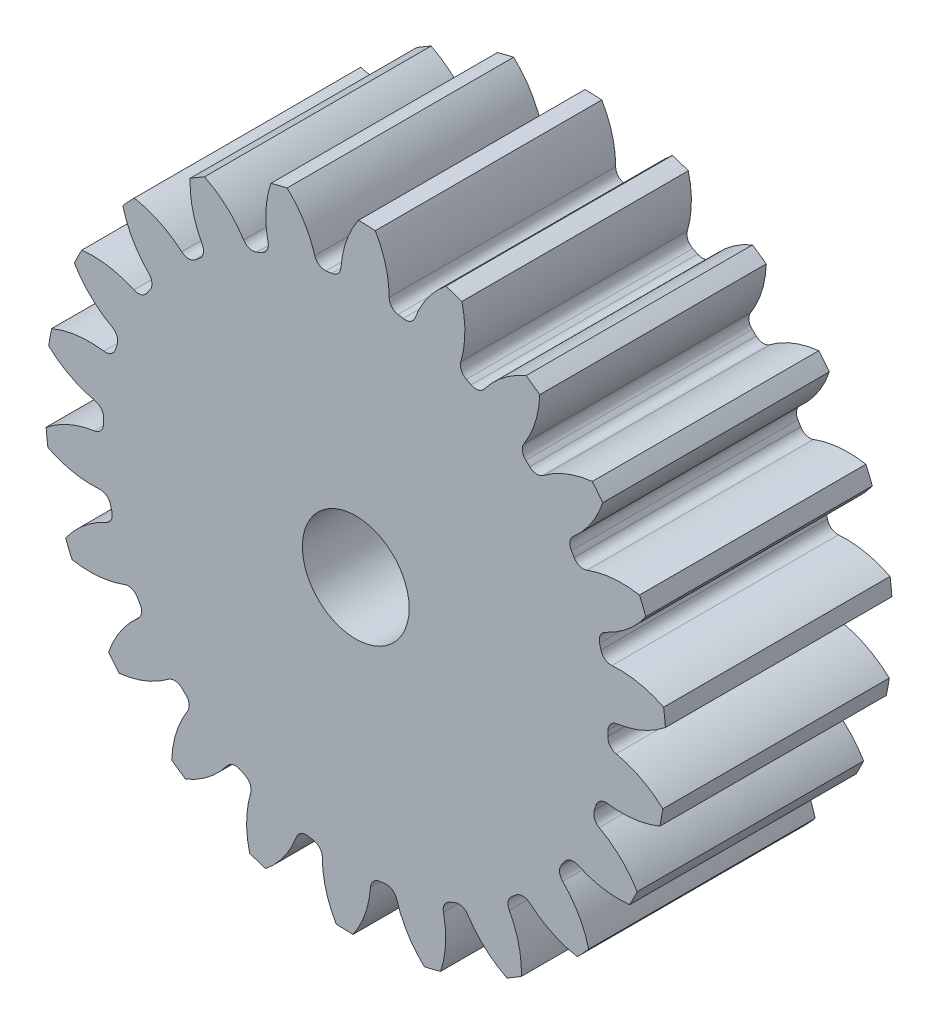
SolidWorks part; units mm, degrees
ref_plane "Front" through (0, 0, 0) normal (0, 0, 1) x (1, 0, 0)
ref_plane "Top" through (0, 0, 0) normal (0, 1, 0) x (1, 0, 0)
ref_plane "Right" through (0, 0, 0) normal (1, 0, 0) x (0, 0, -1)
sketch "Sketch3" plane through (0, 0, 0) normal (0, 0, 1) x (1, 0, 0)
  circle A0 centre (0, 0) radius 121.92
  dimension "od" = 243.84
extrude "gearBody" add sketch "Sketch3" along normal blind 88.9
sketch "Sketch2" plane through (0, 0, 0) normal (0, 0, 1) x (1, 0, 0)
  line L0 (0, 0) -> (97.0259, 40.1894) construction
  line L1 (120.8868, -18.7566) -> (0, 0) construction
  line L2 (0, 0) -> (36.3143, 0) construction
  line L3 (111.6901, 3.9507) -> (111.12, -11.943) construction
  line L5 (111.4051, -3.9962) -> (0, 0) construction
  line L7 (0, 0) -> (105.02, 0) construction
  arc A0 (105.0025, 1.9186) -> (104.5952, -9.437) centre (0, 0) ccw construction
  arc A1 (121.5311, 9.73) -> (120.5216, -18.4126) centre (0, 0) ccw construction
  arc A2 (111.6901, 3.9507) -> (111.12, -11.943) centre (0, 0) ccw construction
  arc A3 (98.9529, -4.6047) -> (99.0285, -2.497) centre (0, 0) ccw
  arc A4 (120.8868, -18.7566) -> (102.2048, -8.8376) centre (93.897, -47.038) ccw
  arc A5 (120.8868, -18.7566) -> (121.92, 10.0469) centre (0, 0) ccw
  arc A6 (121.92, 10.0469) -> (102.5753, 1.492) centre (97.0259, 40.1894) cw
  arc A7 (99.0285, -2.497) -> (102.5753, 1.492) centre (103.1623, -2.6012) cw
  arc A8 (102.2048, -8.8376) -> (98.9529, -4.6047) centre (103.0836, -4.7969) cw
  point P6 (121.92, 10.0469)
  point P22 (120.8868, -18.7566)
  dimension "baseDia" = 210.0401
  dimension "od" = 243.84
  dimension "pd" = 223.52
  dimension "rd" = 198.12
  dimension "rFillet" = 4.1351
  dimension "pointX" = 121.92
  dimension "pointY" = 10.0469
  dimension "CTT" = 15.8937
  dimension "flankCenterAngle" = 22.5
extrude "toothCut" cut sketch "Sketch2" along normal through all
pattern_circular "CirPattern1" count 22 over 360 about axis through (0, 0, 0) along (0, 0, 1) of "toothCut"
sketch "hub1Dia" plane through (0, 0, 0) normal (0, 0, -1) x (-1, 0, 0)
  circle A0 centre (0, 0) radius 12.7
  dimension "hub1Dia" = 25.4
sketch "hub2Dia" plane through (0, 0, 88.9) normal (0, 0, 1) x (1, 0, 0)
  circle A0 centre (0, 0) radius 12.7
  dimension "hub2dia" = 25.4
sketch "boreDia" plane through (0, 0, 0) normal (0, 0, 1) x (1, 0, 0)
  circle A0 centre (0, 0) radius 20.955
  dimension "boreDia" = 41.91
extrude "bore" cut sketch "boreDia" against normal mid plane 25400
